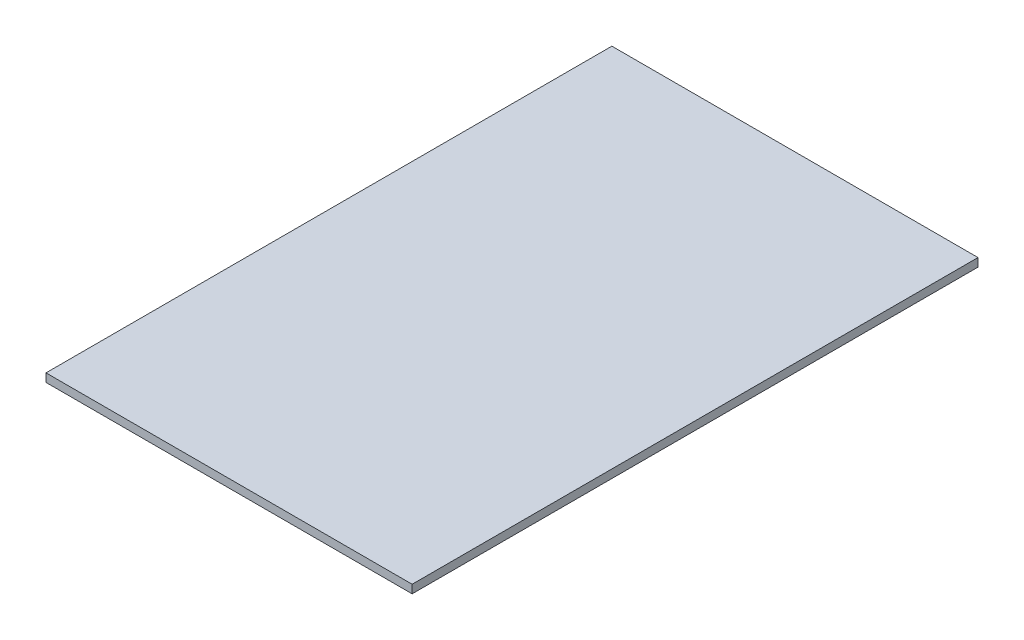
SolidWorks part; units mm, degrees
ref_plane "Front Plane" through (0, 0, 0) normal (0, 0, 1) x (1, 0, 0)
ref_plane "Top Plane" through (0, 0, 0) normal (0, 1, 0) x (1, 0, 0)
ref_plane "Right Plane" through (0, 0, 0) normal (1, 0, 0) x (0, 0, -1)
ref_plane "Plane1" through (0, 3.175, 0) normal (0, 1, 0) x (-1, 0, 0)
sketch "Sketch1" plane through (0, 3.175, 0) normal (0, 1, 0) x (-1, 0, 0)
  line L0 (0, -215.9) -> (0, 0)
  line L1 (0, 0) -> (-139.7, 0)
  line L2 (-139.7, 0) -> (-139.7, -215.9)
  line L3 (-139.7, -215.9) -> (0, -215.9)
extrude "Boss-Extrude1" add sketch "Sketch1" against normal blind 3.175
